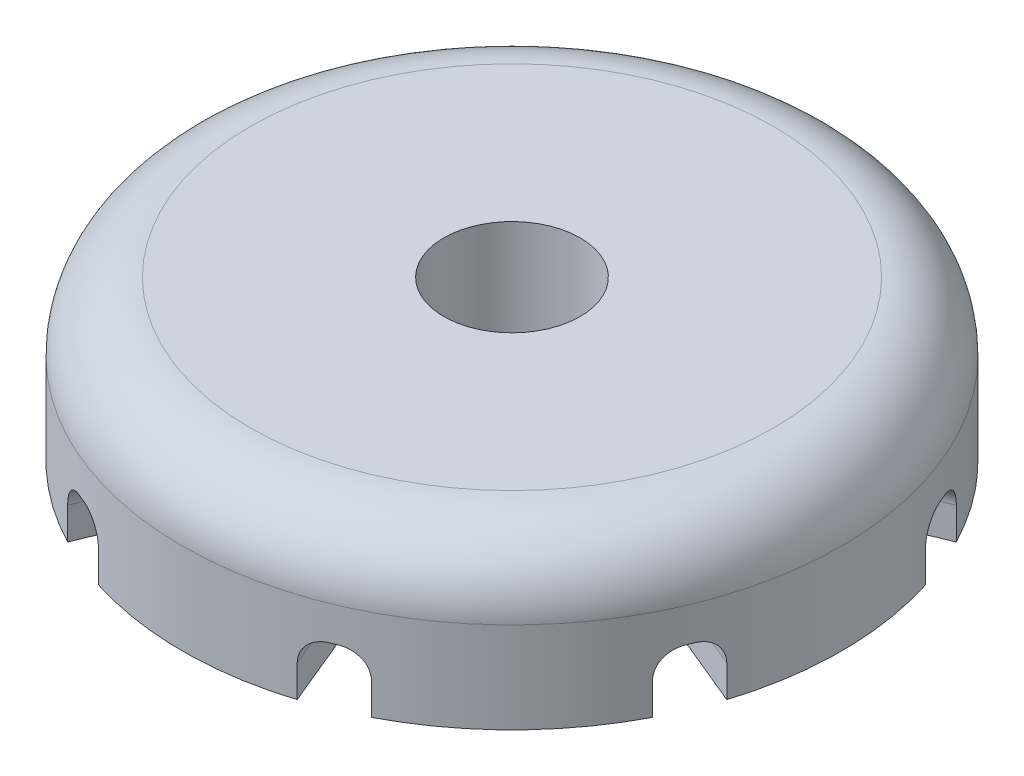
SolidWorks part; units mm, degrees
ref_plane "Ebene vorne" through (0, 0, 0) normal (0, 0, 1) x (1, 0, 0)
ref_plane "Ebene oben" through (0, 0, 0) normal (0, 1, 0) x (1, 0, 0)
ref_plane "Ebene rechts" through (0, 0, 0) normal (1, 0, 0) x (0, 0, -1)
sketch "Gehäuse" plane through (0, 0, 0) normal (0, 1, 0) x (1, 0, 0)
  circle A0 centre (0, 0) radius 14.5
  dimension "D1" = 29
extrude "Aufsatz-Linear austragen3" add sketch "Gehäuse" along normal blind 7
sketch "Sockel" plane through (0, 0, 0) normal (0, -1, 0) x (-1, 0, 0)
  line L1 (3.5, -3.5) -> (-3.5, -3.5)
  line L2 (3.5, -3.5) -> (3.5, 3.5)
  line L3 (3.5, 3.5) -> (-3.5, 3.5)
  line L4 (-3.5, -3.5) -> (-3.5, 3.5)
  line L5 (3.5, -3.5) -> (-3.5, 3.5) construction
  line L6 (3.5, 3.5) -> (-3.5, -3.5) construction
  point P0 (0, 0)
  dimension "D1" = 7
  dimension "D2" = 7
extrude "Aufsatz-Linear austragen4" add sketch "Sockel" along normal blind 1.5
sketch "Skizze4" plane through (0, 0, 0) normal (0, -1, 0) x (1, 0, 0)
  line L0 (6.4672, 2.6788) -> (13.3963, 5.5489) construction
  line L1 (5.9888, 3.8336) -> (12.9179, 6.7038)
  line L2 (6.9455, 1.5239) -> (13.8746, 4.3941)
  line L3 (6.4672, -2.6788) -> (13.3963, -5.5489) construction
  line L4 (6.9455, -1.5239) -> (13.8746, -4.3941)
  line L5 (-923.8795, -382.6834) -> (45270.0971, 18751.4882) construction
  line L6 (5.9888, -3.8336) -> (12.9179, -6.7038)
  line L7 (2.6788, -6.4672) -> (5.5489, -13.3963) construction
  line L8 (3.8336, -5.9888) -> (6.7038, -12.9179)
  line L9 (1.5239, -6.9455) -> (4.3941, -13.8746)
  line L10 (-2.6788, -6.4672) -> (-5.5489, -13.3963) construction
  line L11 (-1.5239, -6.9455) -> (-4.3941, -13.8746)
  line L12 (-3.8336, -5.9888) -> (-6.7038, -12.9179)
  line L13 (-6.4672, -2.6788) -> (-13.3963, -5.5489) construction
  line L14 (-5.9888, -3.8336) -> (-12.9179, -6.7038)
  line L15 (-6.9455, -1.5239) -> (-13.8746, -4.3941)
  line L16 (-6.4672, 2.6788) -> (-13.3963, 5.5489) construction
  line L17 (-6.9455, 1.5239) -> (-13.8746, 4.3941)
  line L18 (-5.9888, 3.8336) -> (-12.9179, 6.7038)
  line L19 (-2.6788, 6.4672) -> (-5.5489, 13.3963) construction
  line L20 (-3.8336, 5.9888) -> (-6.7038, 12.9179)
  line L21 (-1.5239, 6.9455) -> (-4.3941, 13.8746)
  line L22 (2.6788, 6.4672) -> (5.5489, 13.3963) construction
  line L23 (1.5239, 6.9455) -> (4.3941, 13.8746)
  line L24 (3.8336, 5.9888) -> (6.7038, 12.9179)
  line L25 (0, 0) -> (6.4672, 2.6788) construction
  circle A0 centre (0, 0) radius 14.5 construction
  arc A1 (5.9888, 3.8336) -> (6.9455, 1.5239) centre (6.4672, 2.6788) ccw
  circle A2 centre (0, 0) radius 7 construction
  arc A3 (13.8746, 4.3941) -> (12.9179, 6.7038) centre (13.3963, 5.5489) ccw
  arc A4 (6.9455, -1.5239) -> (5.9888, -3.8336) centre (6.4672, -2.6788) ccw
  arc A5 (12.9179, -6.7038) -> (13.8746, -4.3941) centre (13.3963, -5.5489) ccw
  arc A6 (3.8336, -5.9888) -> (1.5239, -6.9455) centre (2.6788, -6.4672) ccw
  arc A7 (4.3941, -13.8746) -> (6.7038, -12.9179) centre (5.5489, -13.3963) ccw
  arc A8 (-1.5239, -6.9455) -> (-3.8336, -5.9888) centre (-2.6788, -6.4672) ccw
  arc A9 (-6.7038, -12.9179) -> (-4.3941, -13.8746) centre (-5.5489, -13.3963) ccw
  arc A10 (-5.9888, -3.8336) -> (-6.9455, -1.5239) centre (-6.4672, -2.6788) ccw
  arc A11 (-13.8746, -4.3941) -> (-12.9179, -6.7038) centre (-13.3963, -5.5489) ccw
  arc A12 (-6.9455, 1.5239) -> (-5.9888, 3.8336) centre (-6.4672, 2.6788) ccw
  arc A13 (-12.9179, 6.7038) -> (-13.8746, 4.3941) centre (-13.3963, 5.5489) ccw
  arc A14 (-3.8336, 5.9888) -> (-1.5239, 6.9455) centre (-2.6788, 6.4672) ccw
  arc A15 (-4.3941, 13.8746) -> (-6.7038, 12.9179) centre (-5.5489, 13.3963) ccw
  arc A16 (1.5239, 6.9455) -> (3.8336, 5.9888) centre (2.6788, 6.4672) ccw
  arc A17 (6.7038, 12.9179) -> (4.3941, 13.8746) centre (5.5489, 13.3963) ccw
  point P4 (9.9317, 4.1138)
  point P19 (9.9317, -4.1138)
  point P26 (4.1138, -9.9317)
  point P33 (-4.1138, -9.9317)
  point P40 (-9.9317, -4.1138)
  point P47 (-9.9317, 4.1138)
  point P54 (-4.1138, 9.9317)
  point P61 (4.1138, 9.9317)
  dimension "D1" = 14
  dimension "D2" = 1.25
  dimension "D3" = 8
extrude "Schnitt-Linear austragen1" cut sketch "Skizze4" against normal blind 2.5
fillet "Verrundung1" radius 1.1 24 edges at (2.9487, 2.5, 10.3851) (5.2584, 2.5, 9.4284) (-5.2584, 2.5, 9.4284) (-2.9487, 2.5, 10.3851) (-10.3851, 2.5, 2.9487) (-9.4284, 2.5, 5.2584) (-9.4284, 2.5, -5.2584) (-10.3851, 2.5, -2.9487) (-2.9487, 2.5, -10.3851) (-5.2584, 2.5, -9.4284) (5.2584, 2.5, -9.4284) (2.9487, 2.5, -10.3851) (10.3851, 2.5, -2.9487) (9.4284, 2.5, -5.2584) (9.4284, 2.5, 5.2584) (10.3851, 2.5, 2.9487) (2.2004, 2.5, 5.3123) (-2.2004, 2.5, 5.3123) (-5.3123, 2.5, 2.2004) (-5.3123, 2.5, -2.2004) (-2.2004, 2.5, -5.3123) (2.2004, 2.5, -5.3123) (5.3123, 2.5, -2.2004) (5.3123, 2.5, 2.2004)
fillet "Verrundung2" radius 3 1 edges at (0, 7, 14.5)
sketch "Skizze5" plane through (0, -1.5, 0) normal (0, -1, 0) x (-1, 0, 0)
  circle A0 centre (0, 0) radius 3
  dimension "D1" = 6
extrude "Schnitt-Linear austragen2" cut sketch "Skizze5" against normal through all
